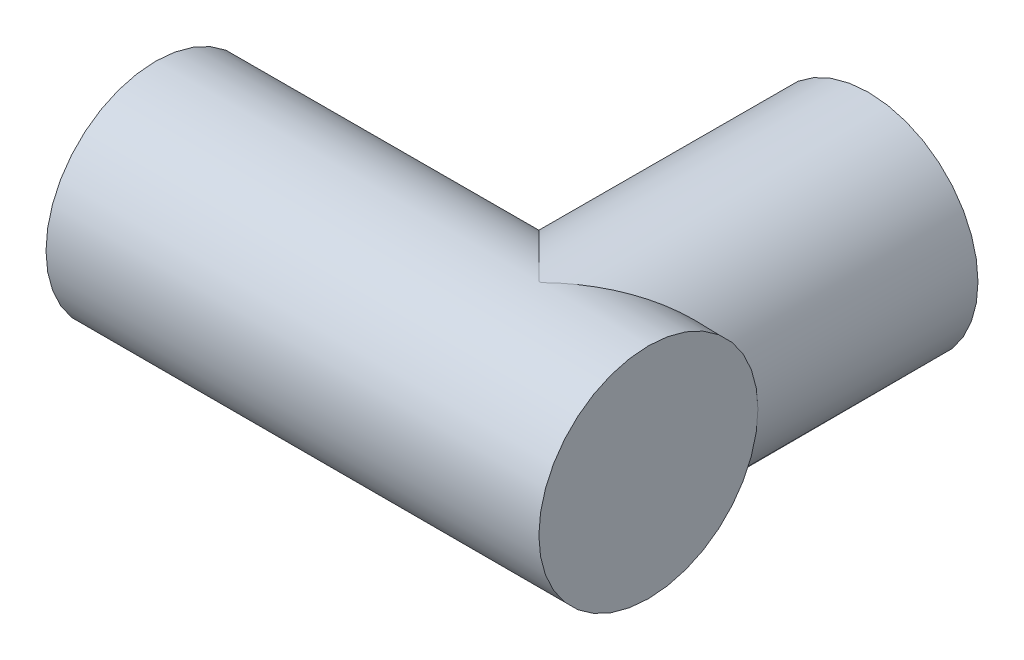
SolidWorks part; units mm, degrees
ref_plane "Front Plane" through (0, 0, 0) normal (0, 0, 1) x (1, 0, 0)
ref_plane "Top Plane" through (0, 0, 0) normal (0, 1, 0) x (1, 0, 0)
ref_plane "Right Plane" through (0, 0, 0) normal (1, 0, 0) x (0, 0, -1)
imported_body "Dynamic_Axel.step<1>"
sketch "Sketch1" plane through (-88.9, 0, 0) normal (-1, 0, 0) x (0, 0, 1)
  line L0 (51.0386, 25.4) -> (51.0386, -26.1973) construction
  line L1 (76.4386, 0) -> (25.6386, 0) construction
  circle A0 centre (51.0386, 0) radius 25.4 construction
  circle A1 centre (51.0386, 0) radius 5.08
extrude "Boss-Extrude1" add sketch "Sketch1" along normal blind 5.08
